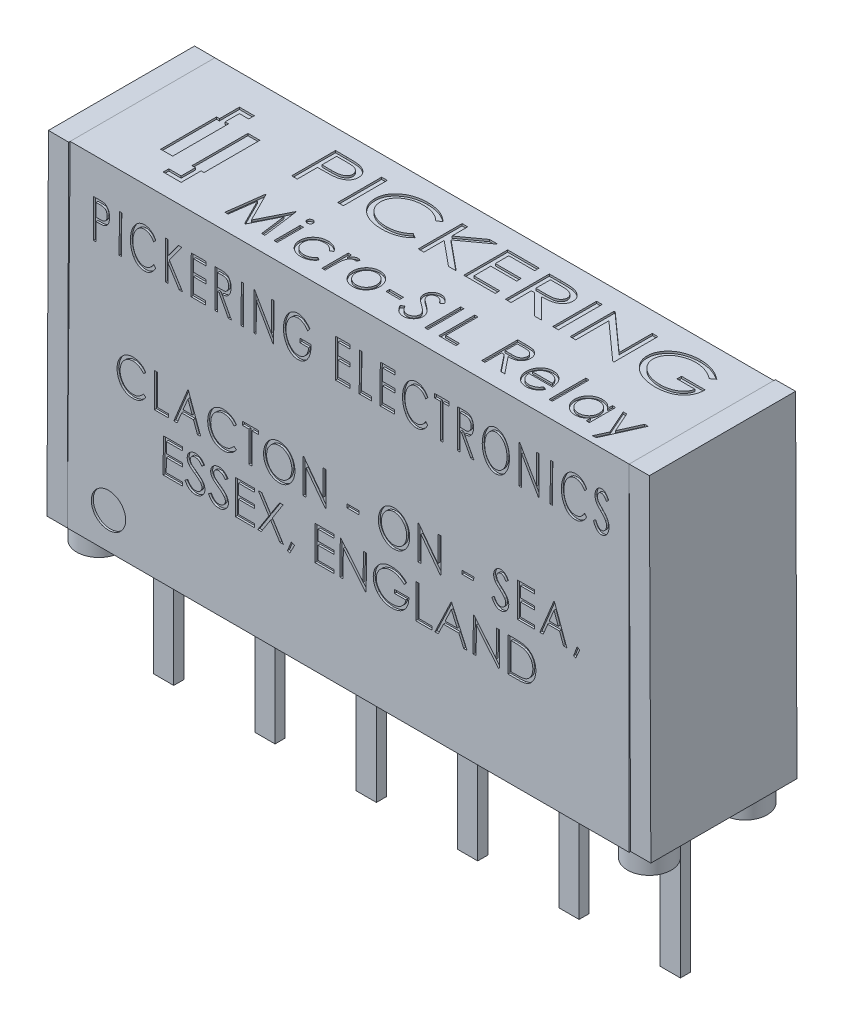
SolidWorks part; units mm, degrees
ref_plane "Front Plane" through (0, 0, 0) normal (0, 0, 1) x (1, 0, 0)
ref_plane "Top Plane" through (0, 0, 0) normal (0, 1, 0) x (1, 0, 0)
ref_plane "Right Plane" through (0, 0, 0) normal (1, 0, 0) x (0, 0, -1)
sketch "Sketch1" plane through (0, 0, 0) normal (0, 1, 0) x (1, 0, 0)
  line L1 (7.042, -1.85) -> (-7.042, -1.85)
  line L2 (7.042, -1.85) -> (7.042, 1.85)
  line L3 (7.042, 1.85) -> (-7.042, 1.85)
  line L4 (-7.042, -1.85) -> (-7.042, 1.85)
  line L5 (7.042, -1.85) -> (-7.042, 1.85) construction
  line L6 (7.042, 1.85) -> (-7.042, -1.85) construction
  point P0 (0, 0)
  dimension "D1" = 3.7
  dimension "D2" = 14.084
extrude "Main body" add sketch "Sketch1" along normal blind 8.392 draft 0.25
sketch "Sketch2" plane through (-7.0419, 0.0307, 0) normal (-1, 0.0044, 0) x (0, 0, 1)
  line L0 (-1.85, -0.0307) -> (1.85, -0.0307) construction
  line L1 (-1.8134, 8.3614) -> (1.85, 8.3614)
  line L2 (-1.8134, 8.3614) -> (-1.8134, -0.0307)
  line L3 (-1.8134, -0.0307) -> (1.85, -0.0307)
  line L4 (1.85, 8.3614) -> (1.85, -0.0307)
extrude "side 1" add sketch "Sketch2" along normal blind 0.508 separate body
sketch "Sketch3" plane through (7.0419, 0.0307, 0) normal (1, 0.0044, 0) x (0, 0, -1)
  line L0 (-1.85, -0.0307) -> (1.85, -0.0307) construction
  line L1 (-1.8134, 8.3614) -> (1.85, 8.3614)
  line L2 (-1.8134, 8.3614) -> (-1.8134, -0.0307)
  line L3 (-1.8134, -0.0307) -> (1.85, -0.0307)
  line L4 (1.85, 8.3614) -> (1.85, -0.0307)
extrude "side 2" add sketch "Sketch3" along normal blind 0.508 separate body
sketch "Sketch4" plane through (0, 0, 0) normal (0, -1, 0) x (1, 0, 0)
  line L3 (-7.042, 1.85) -> (7.042, 1.85) construction
  line L4 (-7.55, -1.8134) -> (-7.55, 1.85) construction
  line L5 (7.042, -1.85) -> (-7.042, -1.85) construction
  line L6 (7.55, 1.8134) -> (7.55, -1.85) construction
  circle A0 centre (-6.9, 1.2) radius 0.55
  circle A1 centre (-6.9, -1.2) radius 0.55
  circle A2 centre (6.9, 1.2) radius 0.55
  circle A3 centre (6.9, -1.2) radius 0.55
  dimension "D1" = 1.1
  dimension "D2" = 0.65
  dimension "D3" = 0.65
  dimension "D4" = 1.1
  dimension "D5" = 0.65
  dimension "D6" = 0.65
  dimension "D7" = 1.1
  dimension "D8" = 0.65
  dimension "D9" = 1.1
extrude "Feet" add sketch "Sketch4" along normal blind 0.508 separate body
sketch "Sketch5" plane through (0, 0, 0) normal (0, -1, 0) x (1, 0, 0)
  line L1 (-6.096, -0.127) -> (-6.604, -0.127)
  line L2 (-6.096, -0.127) -> (-6.096, 0.127)
  line L3 (-6.096, 0.127) -> (-6.604, 0.127)
  line L4 (-6.604, -0.127) -> (-6.604, 0.127)
  line L5 (-6.096, -0.127) -> (-6.604, 0.127) construction
  line L6 (-6.096, 0.127) -> (-6.604, -0.127) construction
  line L7 (-1.016, -0.127) -> (-1.524, -0.127)
  line L8 (-1.016, -0.127) -> (-1.016, 0.127)
  line L9 (-1.016, 0.127) -> (-1.524, 0.127)
  line L10 (-1.524, -0.127) -> (-1.524, 0.127)
  line L11 (-1.016, -0.127) -> (-1.524, 0.127) construction
  line L12 (-1.016, 0.127) -> (-1.524, -0.127) construction
  line L13 (3.556, -0.127) -> (4.064, -0.127)
  line L14 (3.556, -0.127) -> (3.556, 0.127)
  line L15 (3.556, 0.127) -> (4.064, 0.127)
  line L16 (4.064, -0.127) -> (4.064, 0.127)
  line L17 (3.556, -0.127) -> (4.064, 0.127) construction
  line L18 (3.556, 0.127) -> (4.064, -0.127) construction
  line L19 (6.604, -0.127) -> (6.096, -0.127)
  line L20 (6.604, -0.127) -> (6.604, 0.127)
  line L21 (6.604, 0.127) -> (6.096, 0.127)
  line L22 (6.096, -0.127) -> (6.096, 0.127)
  line L23 (6.604, -0.127) -> (6.096, 0.127) construction
  line L24 (6.604, 0.127) -> (6.096, -0.127) construction
  line L26 (-3.556, -0.127) -> (-4.064, -0.127)
  line L27 (-3.556, -0.127) -> (-3.556, 0.127)
  line L28 (-3.556, 0.127) -> (-4.064, 0.127)
  line L29 (-4.064, -0.127) -> (-4.064, 0.127)
  line L30 (-3.556, -0.127) -> (-4.064, 0.127) construction
  line L31 (-3.556, 0.127) -> (-4.064, -0.127) construction
  line L32 (1.524, -0.127) -> (1.016, -0.127)
  line L33 (1.524, -0.127) -> (1.524, 0.127)
  line L34 (1.524, 0.127) -> (1.016, 0.127)
  line L35 (1.016, -0.127) -> (1.016, 0.127)
  line L36 (1.524, -0.127) -> (1.016, 0.127) construction
  line L37 (1.524, 0.127) -> (1.016, -0.127) construction
  line L39 (-7.55, -1.8134) -> (-7.55, 1.85) construction
  point P0 (-6.35, 0)
  point P5 (-1.27, 0)
  point P10 (3.81, 0)
  point P16 (6.35, 0)
  point P21 (-7.55, 0.0183)
  point P23 (-3.81, 0)
  point P28 (1.27, 0)
  dimension "D1" = 0.508
  dimension "D2" = 0.254
  dimension "D3" = 0.508
  dimension "D4" = 0.254
  dimension "D5" = 0.254
  dimension "D6" = 0.254
  dimension "D7" = 0.508
  dimension "D8" = 0.508
  dimension "D9" = 2.54
  dimension "D10" = 2.54
  dimension "D11" = 2.54
  dimension "D12" = 2.54
  dimension "D13" = 0.508
  dimension "D14" = 0.508
  dimension "D15" = 2.54
  dimension "D16" = 1.2
extrude "Pins" add sketch "Sketch5" along normal blind 3.808
sketch "Sketch7"
  dimension "D1" = 10.4
  dimension "D2" = 0.4
  dimension "D3" = 1.6
  dimension "D4" = 0.4
  dimension "D5" = 1
  dimension "D6" = 1.4
  dimension "D7" = 0.3
  dimension "D8" = 0.45
  dimension "D9" = 0.3
  dimension "D10" = 1.4
  dimension "D11" = 0.14
  dimension "D12" = 0.14
  dimension "D13" = 0.14
  dimension "D14" = 0.14
  dimension "D15" = 0.5
  dimension "D16" = 0.5
extrude "top face writing" cut sketch "Sketch7" against normal blind 0.05
sketch "Sketch8"
  dimension "D1" = 1.85
  dimension "D2" = 13.2
  dimension "D3" = 0.442
  dimension "D4" = 2.9
  dimension "D5" = 1.3
extrude "Address" cut sketch "Sketch8" against normal blind 0.05
sketch "Sketch9"
  dimension "D1" = 3
extrude "Relay type" add sketch "Sketch9" along normal blind 0.0001
